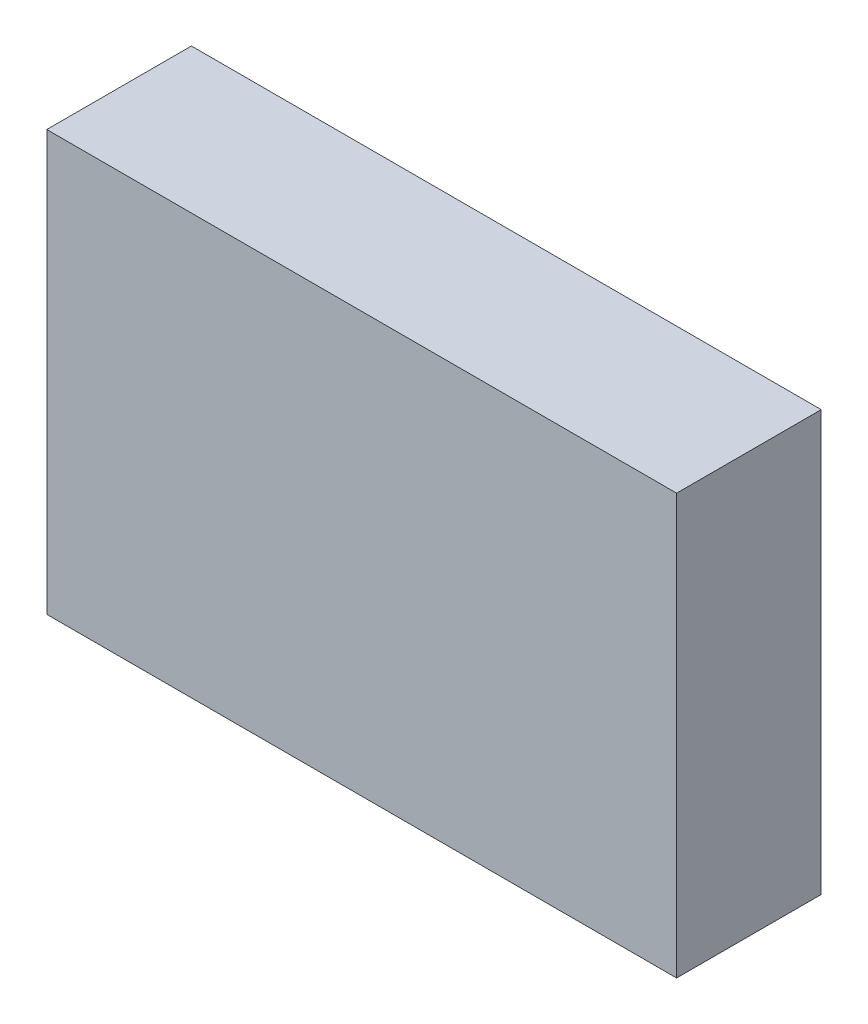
SolidWorks part; units mm, degrees
ref_plane "Front Plane" through (0, 0, 0) normal (0, 0, 1) x (1, 0, 0)
ref_plane "Top Plane" through (0, 0, 0) normal (0, 1, 0) x (1, 0, 0)
ref_plane "Right Plane" through (0, 0, 0) normal (1, 0, 0) x (0, 0, -1)
sketch "GENERAL" plane through (0, 0, 0) normal (0, 0, 1) x (1, 0, 0)
  line L4 (-3.81, -2.54) -> (3.81, -2.54)
  line L5 (3.81, -2.54) -> (3.81, 2.54)
  line L6 (3.81, 2.54) -> (-3.81, 2.54)
  line L7 (-3.81, 2.54) -> (-3.81, -2.54)
extrude "Boss-Extrude1" add sketch "GENERAL" along normal blind 1.75
